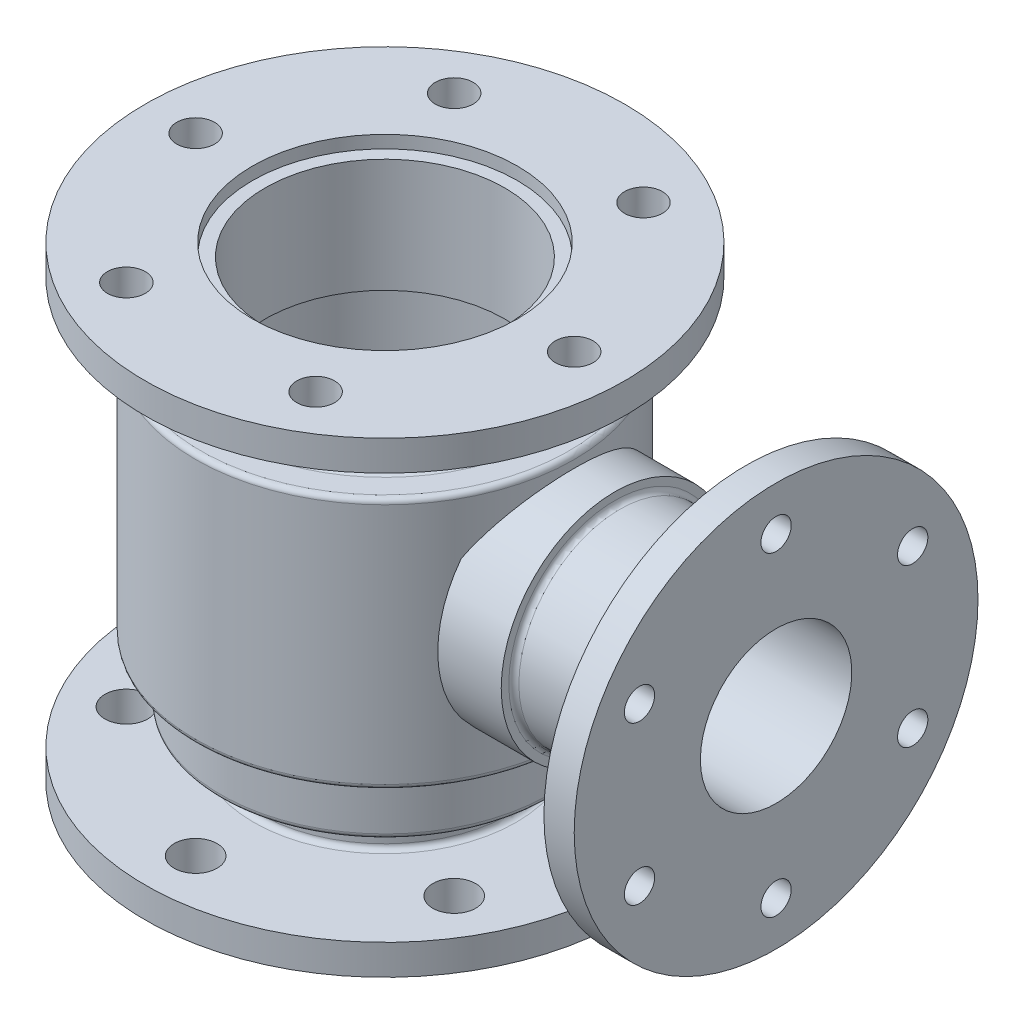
SolidWorks part; units mm, degrees
ref_plane "Front" through (0, 0, 0) normal (0, 0, 1) x (1, 0, 0)
ref_plane "Top" through (0, 0, 0) normal (0, 1, 0) x (1, 0, 0)
ref_plane "Right" through (0, 0, 0) normal (1, 0, 0) x (0, 0, -1)
sketch "Sketch1" plane through (0, 0, 0) normal (0, 0, 1) x (1, 0, 0)
  line L0 (0, 0) -> (0, 211.1396) construction
  line L1 (36, 0) -> (95, 0)
  line L2 (95, 0) -> (95, 12)
  line L3 (95, 12) -> (52, 12)
  line L4 (50, 14) -> (50, 24)
  line L5 (52, 26) -> (63, 26)
  line L6 (65, 28) -> (65, 48)
  line L7 (67, 50) -> (73, 50)
  line L8 (75, 52) -> (75, 148)
  line L9 (73, 150) -> (64.5, 150)
  line L10 (62.5, 152) -> (62.5, 171)
  line L11 (64.5, 173) -> (95, 173)
  line L12 (95, 173) -> (95, 185)
  line L13 (95, 185) -> (52.5, 185)
  line L14 (52.5, 185) -> (52.5, 180)
  line L15 (52.5, 180) -> (47.5, 180)
  line L16 (47.5, 180) -> (47.5, 135)
  line L17 (47.5, 135) -> (49.5, 135)
  line L18 (52.5, 132) -> (52.5, 66)
  line L19 (49.5, 63) -> (43.5, 63)
  line L20 (43.5, 63) -> (43.5, 48)
  line L21 (41.5, 46) -> (36, 46)
  line L22 (36, 46) -> (36, 0)
  line L23 (43.5, 48) -> (41.5, 46)
  arc A0 (50, 14) -> (52, 12) centre (52, 14) ccw
  arc A1 (52, 26) -> (50, 24) centre (52, 24) ccw
  arc A2 (65, 28) -> (63, 26) centre (63, 28) cw
  arc A3 (67, 50) -> (65, 48) centre (67, 48) ccw
  arc A4 (75, 52) -> (73, 50) centre (73, 52) cw
  arc A5 (73, 150) -> (75, 148) centre (73, 148) cw
  arc A6 (62.5, 152) -> (64.5, 150) centre (64.5, 152) ccw
  arc A7 (64.5, 173) -> (62.5, 171) centre (64.5, 171) ccw
  arc A8 (52.5, 66) -> (49.5, 63) centre (49.5, 66) cw
  arc A9 (49.5, 135) -> (52.5, 132) centre (49.5, 132) cw
  point P23 (43.5, 46)
  dimension "D1" = 2
  dimension "D24" = 3
  dimension "D2" = 190
  dimension "D3" = 125
  dimension "D4" = 150
  dimension "D5" = 130
  dimension "D6" = 100
  dimension "D7" = 190
  dimension "D8" = 105
  dimension "D9" = 185
  dimension "D10" = 12
  dimension "D11" = 12
  dimension "D12" = 95
  dimension "D13" = 105
  dimension "D14" = 72
  dimension "D15" = 87
  dimension "D16" = 26
  dimension "D17" = 50
  dimension "D19" = 150
  dimension "D20" = 46
  dimension "D21" = 63
  dimension "D22" = 135
  dimension "D23" = 5
revolve "Revolve1" add sketch "Sketch1" angle 360 about L0
sketch "Sketch2" plane through (0, 0, 0) normal (0, 0, 1) x (1, 0, 0)
  line L0 (-79.6331, 100) -> (142.614, 100) construction
  line L1 (-36, 0) -> (36, 0) construction
  line L2 (65.9454, 55) -> (91.0799, 55)
  line L4 (91.0799, 55) -> (91.0799, 58)
  line L5 (93.0799, 60) -> (141, 60)
  line L6 (143, 58) -> (143, 20)
  line L7 (143, 20) -> (155, 20)
  line L8 (155, 20) -> (155, 100)
  line L9 (155, 100) -> (65.9454, 100)
  line L10 (65.9454, 100) -> (65.9454, 55)
  line L11 (75, 52) -> (75, 148) construction
  arc A0 (91.0799, 58) -> (93.0799, 60) centre (93.0799, 58) cw
  arc A1 (141, 60) -> (143, 58) centre (141, 58) cw
  dimension "D2" = 2
  dimension "D1" = 100
  dimension "D3" = 160
  dimension "D4" = 80
  dimension "D5" = 90
  dimension "D6" = 80
  dimension "D7" = 12
revolve "Revolve2" add sketch "Sketch2" angle 360 about L0
sketch "Sketch3" plane through (0, 0, 0) normal (0, 0, 1) x (1, 0, 0)
  line L0 (-84.8023, 100) -> (155, 100) construction
  line L1 (155, 20) -> (155, 180) construction
  line L3 (155, 100) -> (32.5803, 100)
  line L4 (155, 100) -> (155, 70)
  line L5 (155, 70) -> (32.5803, 70)
  line L6 (32.5803, 100) -> (32.5803, 70)
  dimension "D1" = 60
revolve "Cut-Revolve1" cut sketch "Sketch3" angle 360 about L0
sketch "Sketch4" plane through (0, 185, 0) normal (0, 1, 0) x (-1, 0, 0)
  line L0 (79.6331, 0) -> (-142.614, 0) construction
  circle A0 centre (-75, 0) radius 7.5
  circle A1 centre (0, 0) radius 75 construction
  circle A2 centre (-37.5, 64.9519) radius 7.5
  circle A3 centre (37.5, 64.9519) radius 7.5
  circle A4 centre (75, 0) radius 7.5
  circle A5 centre (37.5, -64.9519) radius 7.5
  circle A6 centre (-37.5, -64.9519) radius 7.5
  dimension "D1" = 150
  dimension "D2" = 15
extrude "Cut-Extrude1" cut sketch "Sketch4" against normal up to surface (12 mm away)
sketch "Sketch5" plane through (0, 0, 0) normal (0, -1, 0) x (1, 0, 0)
  circle A0 centre (0, 75) radius 8.5
  circle A1 centre (0, 0) radius 75 construction
  circle A2 centre (64.9519, 37.5) radius 8.5
  circle A3 centre (64.9519, -37.5) radius 8.5
  circle A4 centre (0, -75) radius 8.5
  circle A5 centre (-64.9519, -37.5) radius 8.5
  circle A6 centre (-64.9519, 37.5) radius 8.5
  dimension "D1" = 150
  dimension "D2" = 17
extrude "Cut-Extrude2" cut sketch "Sketch5" against normal up to surface (12 mm away)
sketch "Sketch6" plane through (155, 0, 0) normal (1, 0, 0) x (0, 0, -1)
  line L0 (0, 173) -> (0, 185) construction
  circle A0 centre (0, 162.5) radius 6
  circle A1 centre (0, 100) radius 62.5 construction
  circle A2 centre (0, 100) radius 80 construction
  circle A3 centre (54.1266, 131.25) radius 6
  circle A4 centre (54.1266, 68.75) radius 6
  circle A5 centre (0, 37.5) radius 6
  circle A6 centre (-54.1266, 68.75) radius 6
  circle A7 centre (-54.1266, 131.25) radius 6
  dimension "D1" = 125
  dimension "D2" = 12
extrude "Cut-Extrude3" cut sketch "Sketch6" against normal up to surface (12 mm away)
